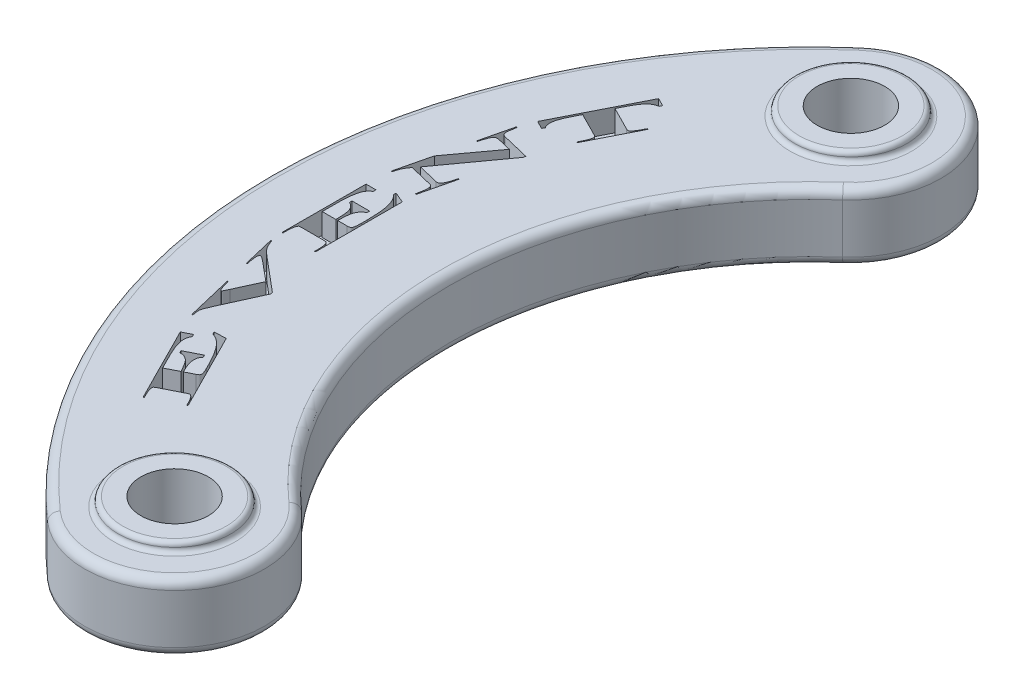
SolidWorks part; units mm, degrees
ref_plane "Front Plane" through (0, 0, 0) normal (0, 0, 1) x (1, 0, 0)
ref_plane "Top Plane" through (0, 0, 0) normal (0, 1, 0) x (1, 0, 0)
ref_plane "Right Plane" through (0, 0, 0) normal (1, 0, 0) x (0, 0, -1)
sketch "Sketch2" plane through (0, 0, 0) normal (0, 1, 0) x (-1, 0, 0)
  line L0 (0, 0) -> (100, 0) construction
  line L1 (0, 0) -> (0, -117.3978) construction
  line L2 (0, 80) -> (0, -80) construction
  line L3 (20, 80) -> (20, -80)
  line L4 (-20, 80) -> (-20, -80)
  line L6 (133.8609, 17.5) -> (145, 17.5)
  line L8 (133.8609, -17.5) -> (145, -17.5)
  line L9 (145, 17.5) -> (145, -17.5)
  line L10 (135, 0) -> (145, -17.5) construction
  line L11 (135, 0) -> (145, 17.5) construction
  line L12 (-145, 17.5) -> (-133.8609, 17.5)
  line L13 (-145, 17.5) -> (-145, -17.5)
  line L14 (-145, -17.5) -> (-133.8609, -17.5)
  line L16 (-145, 17.5) -> (-135, 0) construction
  line L17 (-145, -17.5) -> (-135, 0) construction
  arc A0 (65.9983, -75.128) -> (65.9983, 75.128) centre (0, 0) ccw construction
  arc A1 (79.198, -90.1536) -> (79.198, 90.1536) centre (0, 0) ccw
  arc A2 (52.7987, -60.1024) -> (52.7987, 60.1024) centre (0, 0) ccw
  arc A3 (52.7987, -60.1024) -> (79.198, -90.1536) centre (65.9983, -75.128) ccw
  arc A4 (79.198, 90.1536) -> (52.7987, 60.1024) centre (65.9983, 75.128) ccw
  arc A5 (-65.9983, -75.128) -> (-65.9983, 75.128) centre (0, 0) cw construction
  arc A6 (-79.198, -90.1536) -> (-79.198, 90.1536) centre (0, 0) cw
  arc A7 (-52.7987, -60.1024) -> (-52.7987, 60.1024) centre (0, 0) cw
  arc A8 (-52.7987, -60.1024) -> (-79.198, -90.1536) centre (-65.9983, -75.128) cw
  arc A9 (-79.198, 90.1536) -> (-52.7987, 60.1024) centre (-65.9983, 75.128) cw
  arc A10 (20, 80) -> (-20, 80) centre (0, 80) ccw
  arc A11 (-20, -80) -> (20, -80) centre (0, -80) ccw
  circle A12 centre (65.9983, 75.128) radius 7.5
  circle A13 centre (65.9983, -75.128) radius 7.5
  circle A14 centre (0, -80) radius 7.5
  circle A15 centre (0, 80) radius 7.5
  circle A16 centre (-65.9983, 75.128) radius 7.5
  circle A17 centre (-65.9983, -75.128) radius 7.5
  circle A18 centre (0, 0) radius 135
  point P4 (100, 0)
  point P14 (-100, 0)
  point P21 (0, 0)
  point P39 (135, 0)
  point P44 (-135, 0)
  dimension "D1" = 15
  dimension "D2" = 12.5
  dimension "D3" = 12.5
  dimension "D4" = 270
  dimension "D9" = 170
  dimension "D5" = 10
  dimension "D6" = 10
  dimension "D7" = 35
  dimension "D8" = 100
  dimension "D10" = 160
extrude "Extrude1" add sketch "Sketch2" along normal blind 15 contours A1 A4 A2 A3 | A12 | A13
sketch "Sketch3" plane through (0, 15, 0) normal (0, 1, 0) x (1, 0, 0)
  text T0 "EVENT" font "Times New Roman" height 7.5
extrude "Extrude2" cut sketch "Sketch3" against normal blind 5
fillet "Fillet1" radius 2 6 edges at (-50.9727, 15, -88.3277) (-120, 15, 0) (-50.9727, 15, 88.3277) (-65.9983, 0, -67.628) (-65.9983, 0, 82.628) (-80, 15, 0)
sketch "Sketch4" plane through (0, 15, 0) normal (0, 1, 0) x (1, 0, 0)
  circle A0 centre (-65.9983, -75.128) radius 7.5 construction
  circle A1 centre (-65.9983, 75.128) radius 7.5 construction
  circle A2 centre (-65.9983, -75.128) radius 7.5
  circle A3 centre (-65.9983, 75.128) radius 7.5
  circle A4 centre (-65.9983, -75.128) radius 12.5
  circle A5 centre (-65.9983, 75.128) radius 12.5
  dimension "D1" = 5
  dimension "D2" = 5
extrude "Extrude3" add sketch "Sketch4" along normal blind 2
fillet "Fillet2" radius 2 4 edges at (-50.9727, 0, -88.3277) (-120, 0, 0) (-50.9727, 0, 88.3277) (-80, 0, 0)
fillet "Fillet3" radius 1 4 edges at (-65.9983, 17, 87.628) (-65.9983, 15, 87.628) (-65.9983, 17, -62.628) (-65.9983, 15, -62.628)
